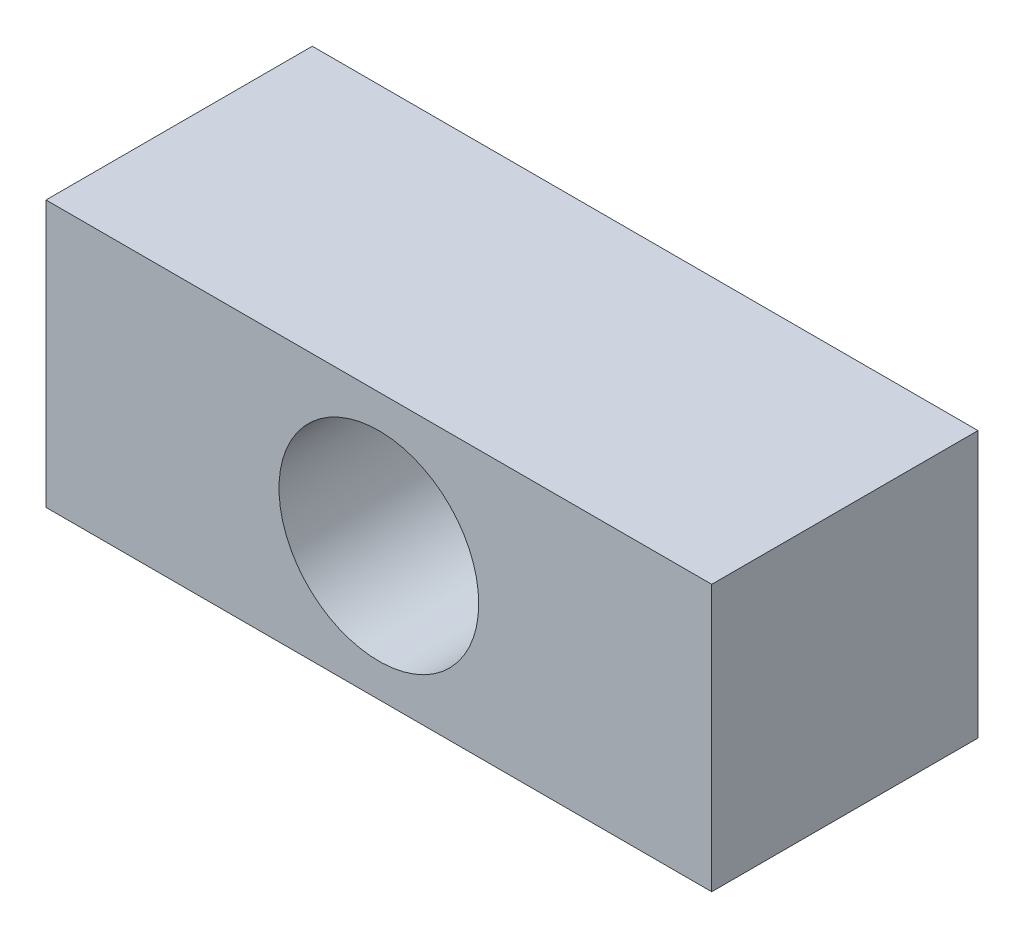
SolidWorks part; units mm, degrees
ref_plane "Ebene vorne" through (0, 0, 0) normal (0, 0, 1) x (1, 0, 0)
ref_plane "Ebene oben" through (0, 0, 0) normal (0, 1, 0) x (1, 0, 0)
ref_plane "Ebene rechts" through (0, 0, 0) normal (1, 0, 0) x (0, 0, -1)
sketch "Skizze1" plane through (0, 0, 0) normal (0, 0, 1) x (1, 0, 0)
  line L1 (0, 0) -> (100, 0)
  line L2 (0, 0) -> (0, 40)
  line L3 (0, 40) -> (100, 40)
  line L4 (100, 0) -> (100, 40)
  circle A0 centre (50, 20) radius 15
  dimension "D3" = 30
  dimension "D1" = 100
  dimension "D2" = 40
  dimension "D4" = 50
  dimension "D5" = 20
extrude "Aufsatz-Linear austragen1" add sketch "Skizze1" along normal blind 40
